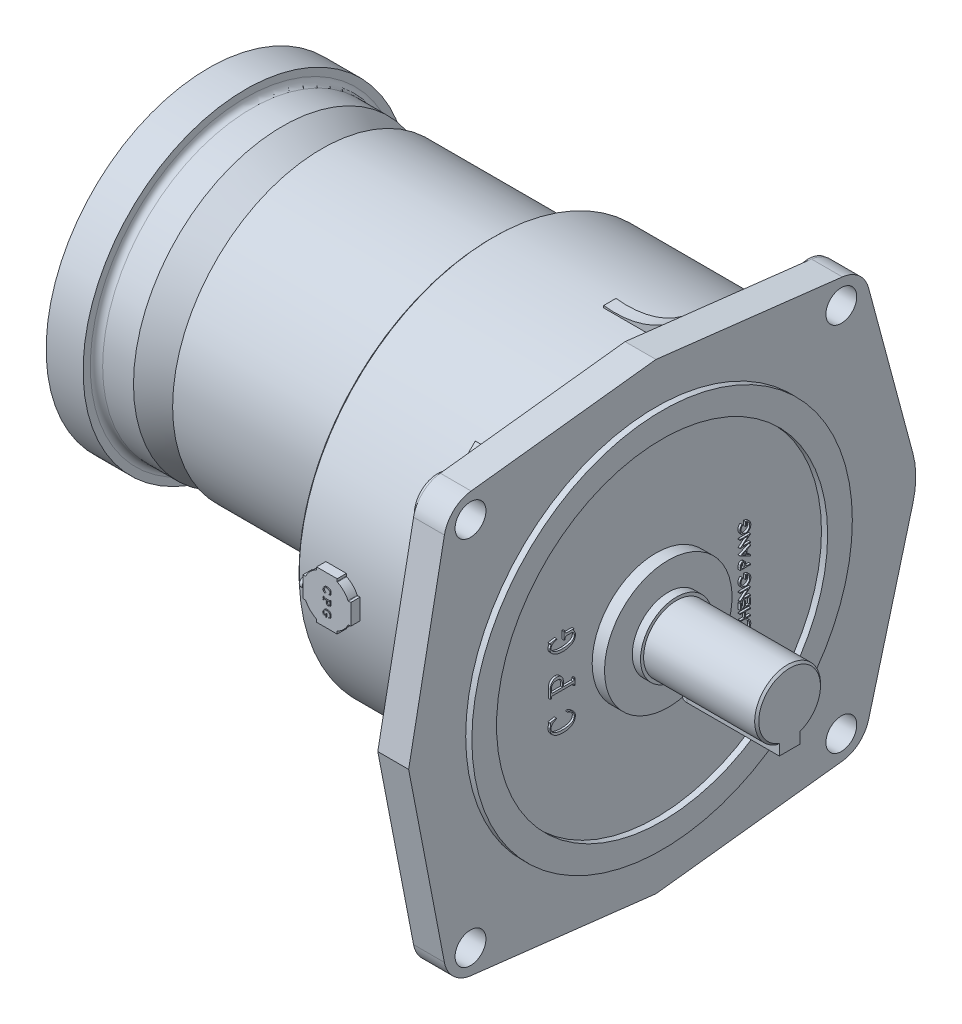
SolidWorks part; units mm, degrees
ref_plane "前视基准面" through (0, 0, 0) normal (0, 0, 1) x (1, 0, 0)
ref_plane "上视基准面" through (0, 0, 0) normal (0, 1, 0) x (1, 0, 0)
ref_plane "右视基准面" through (0, 0, 0) normal (1, 0, 0) x (0, 0, -1)
sketch "草图1" plane through (0, 0, 0) normal (0, 1, 0) x (1, 0, 0)
  line L0 (0, 0) -> (15.7361, 0) construction
  line L1 (0, 0) -> (0, -16)
  line L2 (0, -16) -> (-55, -16)
  line L3 (-55, -16) -> (-55, -17.5)
  line L4 (-55, -17.5) -> (-59, -17.5)
  line L5 (-62, -31) -> (-62, -92.5)
  line L6 (-62, -92.5) -> (-65, -92.5)
  line L7 (-65, -92.5) -> (-65, 0)
  line L8 (-65, 0) -> (0, 0)
  line L9 (-62, -31) -> (-59, -31)
  line L10 (-59, -31) -> (-59, -17.5)
  dimension "D1" = 55
  dimension "D2" = 32
  dimension "D3" = 35
  dimension "D4" = 3
  dimension "D5" = 185
  dimension "D6" = 65
  dimension "D7" = 3
  dimension "D8" = 62
revolve "旋转1" add sketch "草图1" angle 360 about L0
sketch "草图2" plane through (0, 0, 0) normal (0, 1, 0) x (1, 0, 0)
  line L0 (8.0167, 30) -> (-80, 30) construction
  line L1 (-65, 92.5) -> (-65, -92.5) construction
  line L2 (-175, -42.5) -> (-175, 30)
  line L4 (-80, 30) -> (-80, -64.5)
  line L5 (-80, -64.5) -> (-175, -64.5)
  line L6 (-175, -64.5) -> (-175, -42.5)
  line L11 (-80, 30) -> (-175, 30)
  dimension "D1" = 30
  dimension "D2" = 15
  dimension "D3" = 189
  dimension "D5" = 95
revolve "旋转2" add sketch "草图2" angle 360 about L0
sketch "草图12" plane through (-80, 0, 0) normal (1, 0, 0) x (0, 0, -1)
  line L0 (0, -112.5) -> (100.7627, -100.7627)
  line L1 (-100.7627, -100.7627) -> (0, -112.5)
  line L2 (-100.7627, -100.7627) -> (-120.238, 0)
  line L3 (-100.7627, 100.7627) -> (0, 112.5)
  line L4 (100.7627, -100.7627) -> (127.762, 0)
  line L5 (-120.238, 0) -> (-100.7627, 100.7627)
  line L6 (0, 112.5) -> (100.7627, 100.7627)
  line L7 (127.762, 0) -> (100.7627, 100.7627)
  line L8 (167.8979, 0) -> (-107.2143, 0) construction
  line L9 (0, 107.5085) -> (0, -103.3164) construction
  line L10 (0, 0) -> (-90.1561, 90.1561) construction
  line L11 (0, 0) -> (90.1561, 90.1561) construction
  circle A0 centre (0, 0) radius 127.5 construction
  circle A1 centre (-90.1561, 90.1561) radius 7.5
  circle A2 centre (90.1561, 90.1561) radius 7.5
  circle A3 centre (90.1561, -90.1561) radius 7.5
  circle A4 centre (-90.1561, -90.1561) radius 7.5
  dimension "D3" = 255
  dimension "D4" = 15
  dimension "D5" = 15
  dimension "D1" = 225
  dimension "D2" = 248
  dimension "D6" = 15
extrude "拉伸8" add sketch "草图12" along normal up to surface (15 mm away)
sketch "草图5" plane through (0, 0, 0) normal (0, 1, 0) x (1, 0, 0)
  line L0 (0, -5) -> (-45, -5)
  line L1 (0, -16) -> (0, 16) construction
  line L2 (-45, 5) -> (0, 5)
  line L3 (0, 5) -> (0, -5)
  line L4 (35.5, -13.7955) -> (35.5, 19.6443) construction
  arc A0 (-45, -5) -> (-45, 5) centre (-45, 0) cw
  dimension "D2" = 50
  dimension "D1" = 10
  dimension "D3" = 35.5
extrude "拉伸4" add sketch "草图5" against normal blind 19.5
fillet "圆角4" radius 15 4 edges at (-72.5, 100.7627, 100.7627) (-72.5, 100.7627, -100.7627) (-72.5, -100.7627, -100.7627) (-72.5, -100.7627, 100.7627)
fillet "圆角5" radius 40 1 edges at (-72.5, 0, -127.762)
chamfer "倒角1" distance 1 angle 45 2 edges at (0, 16, 0) (-175, 0, -124.5)
sketch "草图18" plane through (-80, 0, 0) normal (-1, 0, 0) x (0, 0, 1)
  line L0 (-30, 0) -> (73.8927, -103.8927) construction
  line L1 (0, -96.25) -> (0, 96.25) construction
  line L2 (89.8548, -102.0333) -> (0, -112.5) construction
  line L3 (36.8216, -66.8216) -> (73.8927, -103.8927)
  line L4 (-30, 0) -> (-90.1561, -90.1561) construction
  line L5 (-88.91, -87.0419) -> (-82.4506, -78.6078)
  line L7 (-30, 0) -> (-30, -109.0055) construction
  line L8 (0, -112.5) -> (-90.6456, -101.9412) construction
  line L9 (-30, -94.5) -> (-30, -109.0055)
  circle A0 centre (-30, 0) radius 94.5 construction
  arc A1 (-103.3989, -90.9242) -> (-90.6456, -101.9412) centre (-88.91, -87.0419) ccw construction
  circle A3 centre (-30, 0) radius 94.5 construction
  dimension "D1" = 45
  dimension "D2" = 10.6235
  dimension "D3" = 45
  dimension "D4" = 52.4264
  dimension "D5" = 14.5055
ref_plane "基准面7" through (-81, 0, 0) normal (1, 0, 0) x (0, 0, -1)
sketch "草图13" plane through (-80, 0, 0) normal (1, 0, 0) x (0, 0, -1)
  line L5 (0, 0) -> (107.7406, 0) construction
  circle A1 centre (90.1561, 90.1561) radius 11.6458
  circle A3 centre (90.1561, 90.1561) radius 7.5
  circle A4 centre (90.1561, -90.1561) radius 7.5 construction
  circle A5 centre (90.1561, -90.1561) radius 7.5
  circle A7 centre (-90.1561, -90.1561) radius 7.5
  arc A10 (90.6456, -101.9412) -> (103.3989, -90.9242) centre (88.91, -87.0419) ccw construction
  circle A11 centre (-90.1561, -90.1561) radius 7.5 construction
  arc A12 (-102.8467, -89.9806) -> (-89.8548, -102.0333) centre (-88.1192, -87.1341) ccw construction
  circle A14 centre (-90.1561, 90.1561) radius 7.5
  circle A15 centre (-90.1561, 90.1561) radius 11.3556
  circle A20 centre (-90.1561, -90.1561) radius 11.3556
  circle A21 centre (90.1561, -90.1561) radius 11.6458
  point P8 (30, 0)
extrude "拉伸9" add sketch "草图13" against normal up to surface (1 mm away)
sketch "草图14" plane through (0, 0, 0) normal (0, 1, 0) x (1, 0, 0)
  line L0 (-80, 30) -> (-175, 30) construction
  line L5 (-80, -89.8548) -> (-80, 0) construction
  line L6 (-117.4264, -64.5) -> (-117.4264, -65.5)
  line L7 (-80, -101.9264) -> (-81, -101.9264)
  line L9 (-80, -64.5) -> (-175, -64.5) construction
  arc A0 (-81, -101.9264) -> (-117.4264, -65.5) centre (-117.4264, -101.9264) ccw
  dimension "D1" = 131.9264
  dimension "D2" = 1
  dimension "D3" = 1
rib "筋17" sketch "草图14" sketch "草图14" thickness 6 extrusion direction parallel to sketch draft on no parameters "D1"=6
pattern_circular "阵列(圆周)16" count 8 over 360 about axis through (0, 0, -30) along (1, 0, 0) of "筋17"
ref_plane "基准面8" through (0, 0, -30) normal (0, 0, 1) x (1, 0, 0)
sketch "草圖1" plane through (0, 0, 0) normal (0, 1, 0) x (1, 0, 0)
  line L0 (-479.824, 47.5) -> (-99.518, 47.5) construction
  line L4 (-175, -25) -> (-275, -25)
  line L10 (-275, -25) -> (-275, 47.5)
  line L13 (-275, 47.5) -> (-175, 47.5)
  line L15 (-175, 47.5) -> (-175, -25)
  dimension "D1" = 47.5
  dimension "D2" = 100
  dimension "D5" = 145
revolve "旋轉1" add sketch "草圖1" angle 360 about L0
sketch "草圖2" plane through (0, 0, 0) normal (0, 1, 0) x (1, 0, 0)
  line L0 (-275, 47.5) -> (-316.5295, 47.5)
  line L1 (-275, -12.5) -> (-275, 47.5)
  line L2 (-37.3334, 47.5) -> (-410.0254, 47.5) construction
  line L3 (-275, 120) -> (-275, -25) construction
  line L4 (-275, -12.5) -> (-274, -12.5)
  line L5 (-274, -12.5) -> (-294.0295, -25)
  line L6 (-294.0295, -25) -> (-309.0295, -25)
  line L7 (-312.0295, -28) -> (-312.0295, -31.5)
  line L8 (-312.0295, -31.5) -> (-330, -31.5)
  line L9 (-330, -31.5) -> (-330, -8.5)
  line L10 (-329, -7.5) -> (-320.0295, -7.5)
  line L11 (-320.0295, -7.5) -> (-320.0295, -2.5871)
  line L12 (-299.0295, 7.9394) -> (-299.0295, 13.5)
  line L13 (-302.0295, 16.5) -> (-317.0295, 16.5)
  line L14 (-318.0295, 17.5) -> (-318.0295, 26.5)
  line L15 (-318.0295, 26.5) -> (-316.8295, 26.5)
  line L16 (-316.5295, 26.8) -> (-316.5295, 47.5)
  line L17 (-319.9433, -2.488) -> (-299.0295, 0.4131)
  arc A0 (-309.0295, -25) -> (-312.0295, -28) centre (-309.0295, -28) ccw
  arc A1 (-299.0295, 0.4131) -> (-297.7756, 5.4999) centre (-299.417, 3.2066) ccw
  arc A2 (-329, -7.5) -> (-330, -8.5) centre (-329, -8.5) ccw
  arc A3 (-319.9433, -2.488) -> (-320.0295, -2.5871) centre (-319.9295, -2.5871) ccw
  arc A4 (-297.7756, 5.4999) -> (-299.0295, 7.9394) centre (-296.0295, 7.9394) cw
  arc A5 (-299.0295, 13.5) -> (-302.0295, 16.5) centre (-302.0295, 13.5) ccw
  arc A6 (-317.0295, 16.5) -> (-318.0295, 17.5) centre (-317.0295, 17.5) cw
  arc A7 (-316.8295, 26.5) -> (-316.5295, 26.8) centre (-316.8295, 26.8) ccw
  point P27 (-330, -7.5)
  point P30 (-320.0295, -2.5)
  point P33 (-299.0295, 6)
  point P38 (-318.0295, 16.5)
  point P41 (-318.0295, 27.5)
  dimension "D9" = 158
  dimension "D19" = 47.5
  dimension "D2" = 120
  dimension "D3" = 55
  dimension "D8" = 145
  dimension "D10" = 110
revolve "旋轉2" add sketch "草圖2" angle 360 about L2
sketch "草圖6" plane through (0, 0, -30) normal (0, 0, 1) x (1, 0, 0)
  line L0 (-174, -94.5) -> (-80, -94.5) construction
  line L1 (-117.4264, -94.5) -> (-80, -94.5)
  line L2 (-117.4264, -94.5) -> (-117.4264, -95.5)
  line L3 (-80, -107.5355) -> (-81, -107.5355)
  line L4 (-80, -102.0333) -> (-80, -112.5) construction
  line L5 (-80, -94.5) -> (-80, -107.5355)
  line L6 (27.925, 0) -> (-220.0967, 0) construction
  line L7 (-80, 94.5) -> (-80, 107.5355)
  line L8 (-80, 107.5355) -> (-81, 107.5355)
  line L9 (-117.4264, 94.5) -> (-117.4264, 95.5)
  line L10 (-117.4264, 94.5) -> (-80, 94.5)
  arc A0 (-117.4264, -95.5) -> (-81, -107.5355) centre (-112.0672, -140.4213) cw
  arc A1 (-117.4264, 95.5) -> (-81, 107.5355) centre (-112.0672, 140.4213) ccw
  dimension "D1" = 1
  dimension "D2" = 1
extrude "伸長4" add sketch "草圖6" along normal mid plane 6 separate body
sketch "草圖7" plane through (-330, 0, 0) normal (-1, 0, 0) x (0, 0, 1)
  line L0 (-131.5945, 0) -> (41.3288, 0) construction
  line L1 (-47.5, 84.2191) -> (-47.5, -84.9666) construction
  circle A0 centre (-47.5, 0) radius 65 construction
  circle A1 centre (-93.4619, 45.9619) radius 4
  circle A2 centre (-1.5381, 45.9619) radius 4
  circle A3 centre (-1.5381, -45.9619) radius 4
  circle A4 centre (-93.4619, -45.9619) radius 4
  dimension "D1" = 130
  dimension "D2" = 8
extrude "伸長5" cut sketch "草圖7" against normal blind 25
sketch "草圖8" plane through (-330, 0, 0) normal (-1, 0, 0) x (0, 0, 1)
  line L9 (-93.9923, 34.825) -> (-82.325, 46.4923)
  line L14 (13.3691, 25.5138) -> (-6.3987, 5.739)
  line L19 (-12.675, 46.4923) -> (-1.0077, 34.825)
  line L21 (-37.0387, 40.1598) -> (-29.9676, 47.2309)
  line L23 (-57.9613, -40.1598) -> (-65.0324, -47.2309)
  line L25 (-29.9676, -47.2309) -> (-37.0387, -40.1598)
  line L26 (-82.325, -46.4923) -> (-93.9923, -34.825)
  line L27 (-87.6598, 10.4613) -> (-94.7309, 17.5324)
  line L28 (-65.0324, 47.2309) -> (-57.9613, 40.1598)
  line L30 (-21.9862, -60.8691) -> (-41.761, -41.1013)
  line L31 (-108.3691, 25.5138) -> (-88.6652, 5.2608)
  line L32 (-21.9862, 60.8691) -> (-42.2392, 41.1652)
  line L33 (-0.2691, 17.5324) -> (-7.3402, 10.4613)
  line L34 (-1.0077, -34.825) -> (-12.675, -46.4923)
  line L35 (-47.2357, -0.2643) -> (-113.4995, -0.2643) construction
  line L36 (13.3691, -25.5138) -> (-6.3348, -5.2608)
  line L37 (-73.0138, -60.8691) -> (-52.7608, -41.1652)
  line L38 (-94.7309, -17.5324) -> (-87.6598, -10.4613)
  line L39 (-108.3691, -25.5138) -> (-88.6013, -5.739)
  line L40 (-7.3402, -10.4613) -> (-0.2691, -17.5324)
  line L41 (-73.0138, 60.8691) -> (-53.239, 41.1013)
  arc A12 (-37.0387, -40.1598) -> (-7.3402, -10.4613) centre (-47.5, 0) ccw
  arc A13 (-73.0138, -60.8691) -> (-21.9862, -60.8691) centre (-47.5, 0) ccw
  arc A14 (-108.3691, 25.5138) -> (-108.3691, -25.5138) centre (-47.5, 0) ccw
  arc A15 (-7.3402, 10.4613) -> (-37.0387, 40.1598) centre (-47.5, 0) ccw
  arc A16 (-52.7608, -41.1652) -> (-41.761, -41.1013) centre (-47.5, 0) ccw
  arc A17 (-57.9613, 40.1598) -> (-87.6598, 10.4613) centre (-47.5, 0) ccw
  arc A18 (13.3691, -25.5138) -> (13.3691, 25.5138) centre (-47.5, 0) ccw
  arc A19 (-42.2392, 41.1652) -> (-53.239, 41.1013) centre (-47.5, 0) ccw
  arc A20 (-88.6652, 5.2608) -> (-88.6013, -5.739) centre (-47.5, 0) ccw
  arc A21 (-21.9862, 60.8691) -> (-73.0138, 60.8691) centre (-47.5, 0) ccw
  arc A22 (-87.6598, -10.4613) -> (-57.9613, -40.1598) centre (-47.5, 0) ccw
  arc A23 (-6.3348, -5.2608) -> (-6.3987, 5.739) centre (-47.5, 0) ccw
  spline S8 degree 2 poles (-65.0324, -47.2309) (-73.8941, -52.0713) (-82.325, -46.4923) knots 0 0 0 1 1 1
  spline S9 degree 2 poles (-94.7309, -17.5324) (-99.5713, -26.3941) (-93.9923, -34.825) knots 0 0 0 1 1 1
  spline S10 degree 2 poles (-0.2691, -17.5324) (4.5713, -26.3941) (-1.0077, -34.825) knots 0 0 0 1 1 1
  spline S11 degree 2 poles (-94.7309, 17.5324) (-99.5713, 26.3941) (-93.9923, 34.825) knots 0 0 0 1 1 1
  spline S12 degree 2 poles (-65.0324, 47.2309) (-73.8941, 52.0713) (-82.325, 46.4923) knots 0 0 0 1 1 1
  spline S13 degree 2 poles (-29.9676, 47.2309) (-21.1059, 52.0713) (-12.675, 46.4923) knots 0 0 0 1 1 1
  spline S14 degree 2 poles (-0.2691, 17.5324) (4.5713, 26.3941) (-1.0077, 34.825) knots 0 0 0 1 1 1
  spline S15 degree 2 poles (-29.9676, -47.2309) (-21.1059, -52.0713) (-12.675, -46.4923) knots 0 0 0 1 1 1
extrude "伸長6" cut sketch "草圖8" against normal blind 38
sketch "草圖9" plane through (-292, 0, 0) normal (-1, 0, 0) x (0, 0, 1)
  circle A0 centre (-47.5, 0) radius 51.5 construction
  circle A1 centre (-83.916, 36.416) radius 3
  circle A2 centre (-11.084, 36.416) radius 3
  circle A3 centre (-11.084, -36.416) radius 3
  circle A4 centre (-83.916, -36.416) radius 3
  dimension "D1" = 103
  dimension "D2" = 6
extrude "伸長7" cut sketch "草圖9" against normal blind 11
sketch "草圖10" plane through (-316.5295, 0, 0) normal (-1, 0, 0) x (0, 0, 1)
  line L0 (-47.5, -16.5253) -> (-47.5, 16) construction
  line L3 (-65.2414, 0) -> (-30.9158, 0) construction
  line L5 (-40.2, 2) -> (-40.2, -2)
  line L6 (-40.2, -2) -> (-42.3765, -2)
  line L7 (-40.2, 2) -> (-42.3765, 2)
  circle A0 centre (-47.5, 0) radius 12.5 construction
  arc A1 (-42.3765, 2) -> (-42.3765, -2) centre (-47.5, 0) ccw
  dimension "D1" = 25
  dimension "D2" = 11
  dimension "D3" = 7.3
  dimension "D4" = 4
extrude "伸長8" cut sketch "草圖10" against normal blind 28
sketch "草圖11" plane through (-316.5295, 0, 0) normal (-1, 0, 0) x (0, 0, 1)
  line L0 (-40.2, -2) -> (-42.3765, -2) construction
  line L1 (-40.2, 2) -> (-40.2, -2) construction
  line L2 (-40.2, 2) -> (-42.3765, 2) construction
  line L3 (-40.2, -2) -> (-42.3765, -2)
  line L4 (-40.2, 2) -> (-40.2, -2)
  line L5 (-40.2, 2) -> (-42.3765, 2)
  circle A0 centre (-47.5, 0) radius 12.5 construction
  circle A1 centre (-47.5, 0) radius 12.5
  arc A2 (-42.3765, 2) -> (-42.3765, -2) centre (-47.5, 0) ccw construction
  arc A3 (-42.3765, 2) -> (-42.3765, -2) centre (-47.5, 0) ccw
extrude "伸長9" add sketch "草圖11" along normal blind 1
sketch "草圖12" plane through (-62, 0, 0) normal (1, 0, 0) x (0, 0, -1)
  circle A0 centre (0, 0) radius 80.5
  circle A1 centre (0, 0) radius 31 construction
  circle A2 centre (0, 0) radius 31
  dimension "D1" = 161
extrude "伸長10" cut sketch "草圖12" against normal blind 3
sketch "草圖13"
  dimension "D1" = 80
  dimension "D2" = 80
  dimension "D3" = 40
  dimension "D4" = 45
  dimension "D5" = 40
extrude "伸長11" add sketch "草圖13" along normal blind 1
ref_plane "平面1" through (0, 0, 69) normal (0, 0, 1) x (1, 0, 0)
sketch "草圖14" plane through (0, 0, 69) normal (0, 0, 1) x (1, 0, 0)
  line L0 (-161, 11.65) -> (-151, 11.65)
  line L1 (-161, 11.65) -> (-161, 10.5119)
  line L2 (-151, 11.65) -> (-151, 10.5119)
  line L3 (-161, -10.5119) -> (-161, -11.65)
  line L4 (-151, -10.5119) -> (-151, -11.65)
  line L5 (-167.65, 5) -> (-166.5119, 5)
  line L6 (-167.65, -5) -> (-166.5119, -5)
  line L7 (-167.65, -5) -> (-167.65, 5)
  line L8 (-161, -11.65) -> (-161, -10.5119)
  line L9 (-151, -11.65) -> (-151, -10.5119)
  line L10 (-151, -11.65) -> (-161, -11.65)
  line L11 (-144.35, -5) -> (-145.4881, -5)
  line L12 (-144.35, 5) -> (-145.4881, 5)
  line L13 (-144.35, 5) -> (-144.35, -5)
  arc A0 (-161.1383, 10.2882) -> (-166.2882, 5.1383) centre (-156, 0) ccw
  arc A1 (-161.1383, 10.2882) -> (-161, 10.5119) centre (-161.25, 10.5119) ccw
  arc A2 (-151, 10.5119) -> (-150.8617, 10.2882) centre (-150.75, 10.5119) ccw
  arc A3 (-166.5119, 5) -> (-166.2882, 5.1383) centre (-166.5119, 5.25) ccw
  arc A4 (-166.2882, -5.1383) -> (-166.5119, -5) centre (-166.5119, -5.25) ccw
  arc A5 (-161, -10.5119) -> (-161.1383, -10.2882) centre (-161.25, -10.5119) ccw
  arc A6 (-150.8617, -10.2882) -> (-151, -10.5119) centre (-150.75, -10.5119) ccw
  arc A7 (-145.4881, -5) -> (-145.7118, -5.1383) centre (-145.4881, -5.25) ccw
  arc A8 (-145.7118, 5.1383) -> (-145.4881, 5) centre (-145.4881, 5.25) ccw
  arc A9 (-145.7118, 5.1383) -> (-150.8617, 10.2882) centre (-156, 0) ccw
  arc A10 (-166.2882, -5.1383) -> (-161.1383, -10.2882) centre (-156, 0) ccw
  arc A11 (-150.8617, -10.2882) -> (-145.7118, -5.1383) centre (-156, 0) ccw
extrude "伸長12" add sketch "草圖14" against normal blind 4.5 separate body contours A6 A11 A7 L11 L13 L12 A8 A9 A2 L2 L0 L1 A1 A0 A3 L5 L7 L6 A4 A10 A5 L3 L10 L4
sketch "草圖15"
extrude "伸長13" add sketch "草圖15" along normal blind 0.5
sketch "草圖16" plane through (0, 0, 0) normal (0, 1, 0) x (1, 0, 0)
  line L0 (-169.6841, -66.75) -> (-161.6841, -66.75)
  line L1 (-169.6841, -66.75) -> (-169.6841, -64.75)
  line L2 (-168.1841, -65.5) -> (-168.1841, -64.75)
  line L3 (-123.75, -69) -> (123.75, -69) construction
  line L13 (-166.1841, -65.5) -> (-161.6841, -65.75)
  line L15 (-168.1841, -65.5) -> (-166.1841, -65.5)
  line L23 (-169.6841, -64.75) -> (-168.1841, -64.75)
  line L24 (-166.1841, -66.75) -> (-166.1841, -65.5)
  line L25 (-161.6841, -66.75) -> (-161.6841, -65.75)
  dimension "D1" = 2.25
revolve "旋轉3" add sketch "草圖16" angle 360 about L0
equation "\"D1@拉伸4\" = \"D3@草图5\"-\"D2@草图1\"/2"
equation "\"D3@草图1\" = \"D2@草图1\"+3"
equation "\"D5@草图1\" = \"D1@草圖12\"+24"
